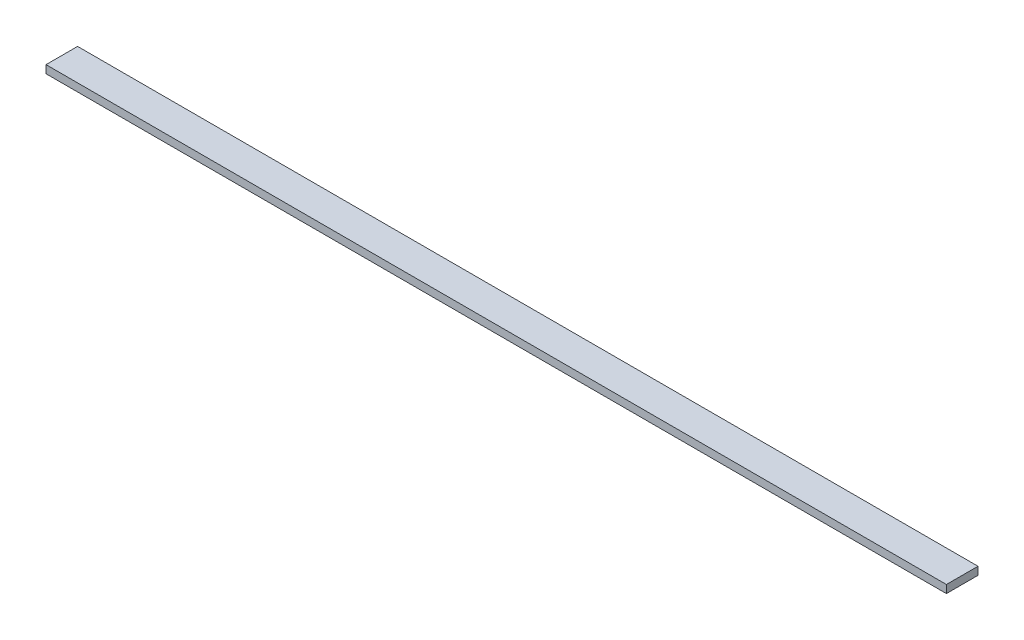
SolidWorks part; units mm, degrees
ref_plane "Front Plane" through (0, 0, 0) normal (0, 0, 1) x (1, 0, 0)
ref_plane "Top Plane" through (0, 0, 0) normal (0, 1, 0) x (1, 0, 0)
ref_plane "Right Plane" through (0, 0, 0) normal (1, 0, 0) x (0, 0, -1)
sketch "Sketch1" plane through (0, 0, 0) normal (0, 1, 0) x (1, 0, 0)
  line L1 (-361.95, -12.7) -> (361.95, -12.7)
  line L2 (-361.95, -12.7) -> (-361.95, 12.7)
  line L3 (-361.95, 12.7) -> (361.95, 12.7)
  line L4 (361.95, -12.7) -> (361.95, 12.7)
  line L5 (-361.95, -12.7) -> (361.95, 12.7) construction
  line L6 (-361.95, 12.7) -> (361.95, -12.7) construction
  point P0 (0, 0)
extrude "Boss-Extrude1" add sketch "Sketch1" along normal blind 6.35
equation "\"horizontal-component-length\"= \"railing-width\" - \"railing padding\""
equation "\"horizontal-component-width\"= 1in"
equation "\"D1@Sketch1\"=\"horizontal-component-length\""
equation "\"D2@Sketch1\"=\"horizontal-component-width\""
equation "\"material-thickness\"= .25in"
equation "\"D1@Boss-Extrude1\"=\"material-thickness\""
equation "\"railing-width\" = 29in"
equation "\"railing padding\"= .5in"
